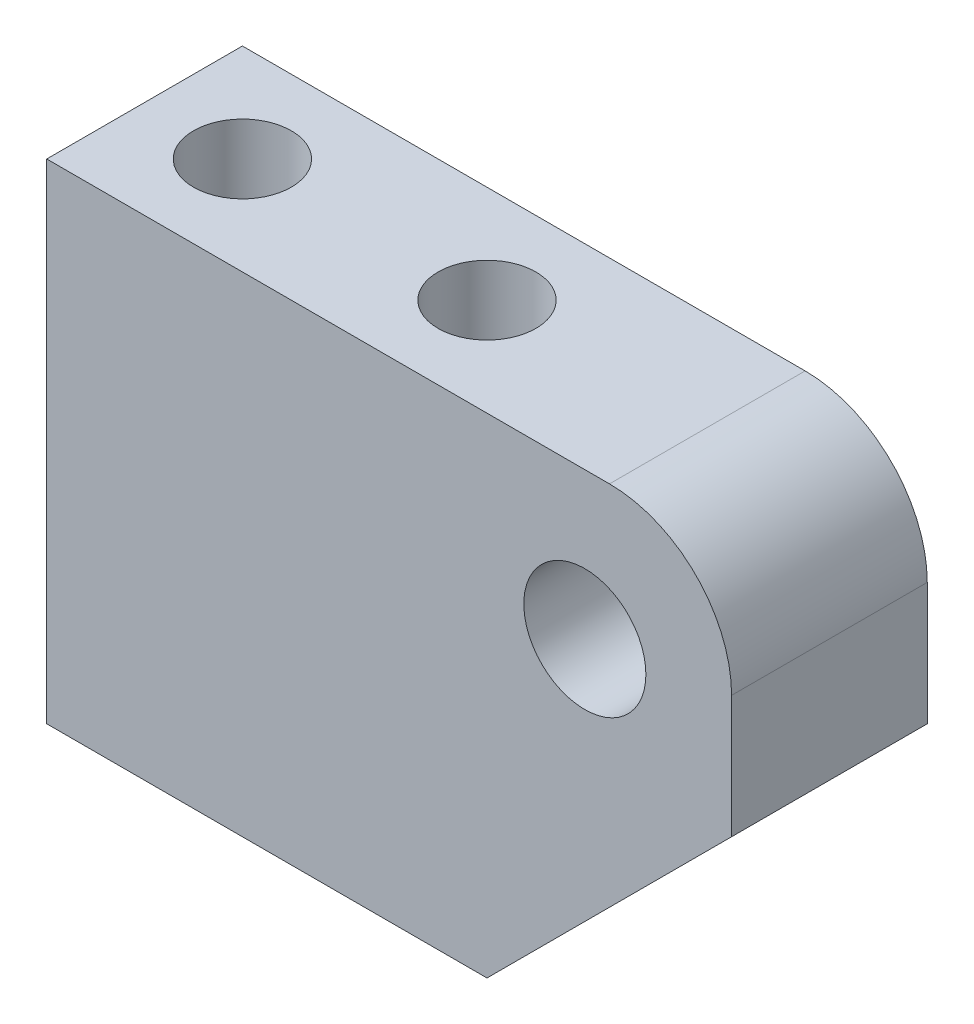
SolidWorks part; units mm, degrees
ref_plane "Front Plane" through (0, 0, 0) normal (0, 0, 1) x (1, 0, 0)
ref_plane "Top Plane" through (0, 0, 0) normal (0, 1, 0) x (1, 0, 0)
ref_plane "Right Plane" through (0, 0, 0) normal (1, 0, 0) x (0, 0, -1)
sketch "Sketch1" plane through (0, 0, 0) normal (0, 0, 1) x (1, 0, 0)
  line L0 (0, 0) -> (-12.7, 0) construction
  line L1 (-34.925, 9.525) -> (9.525, 9.525)
  line L2 (9.525, 9.525) -> (9.525, -6.35)
  line L3 (9.525, -6.35) -> (-6.35, -22.225)
  line L4 (-6.35, -22.225) -> (-34.925, -22.225)
  line L5 (-34.925, -22.225) -> (-34.925, 9.525)
  line L6 (-28.575, 9.525) -> (-28.575, -22.225)
  line L7 (-12.7, 9.525) -> (-12.7, -22.225)
  line L8 (-12.7, 0) -> (-28.575, 0) construction
  circle A0 centre (0, 0) radius 3.9624
  dimension "D1" = 7.9248
  dimension "D2" = 9.525
  dimension "D3" = 9.525
  dimension "D4" = 31.75
  dimension "D5" = 34.925
  dimension "D6" = 15.875
  dimension "D7" = 28.575
  dimension "D8" = 6.35
  dimension "D9" = 15.875
sketch "Sketch2" plane through (0, 0, 0) normal (0, 0, 1) x (1, 0, 0)
  line L0 (-6.35, -22.225) -> (-34.925, -22.225) construction
  line L1 (-34.925, -22.225) -> (-34.925, 9.525) construction
  line L2 (-34.925, 9.525) -> (9.525, 9.525) construction
  line L3 (9.525, 9.525) -> (9.525, -6.35) construction
  line L4 (9.525, -6.35) -> (-6.35, -22.225) construction
  line L5 (-6.35, -22.225) -> (-34.925, -22.225)
  line L6 (-34.925, -22.225) -> (-34.925, 9.525)
  line L7 (-34.925, 9.525) -> (9.525, 9.525)
  line L8 (9.525, 9.525) -> (9.525, -6.35)
  line L9 (9.525, -6.35) -> (-6.35, -22.225)
  circle A0 centre (0, 0) radius 3.9624 construction
  circle A1 centre (0, 0) radius 3.9624
extrude "Boss-Extrude1" add sketch "Sketch2" along normal mid plane 12.7
sketch "Sketch3" plane through (0, 0, 0) normal (0, 1, 0) x (1, 0, 0)
  circle A0 centre (-12.7, 0) radius 3.175
  circle A1 centre (-28.575, 0) radius 3.175
  dimension "D1" = 6.35
extrude "Cut-Extrude1" cut sketch "Sketch3" against normal mid plane 76.2
fillet "Fillet1" radius 7.9248 1 edges at (9.525, 9.525, 0)
